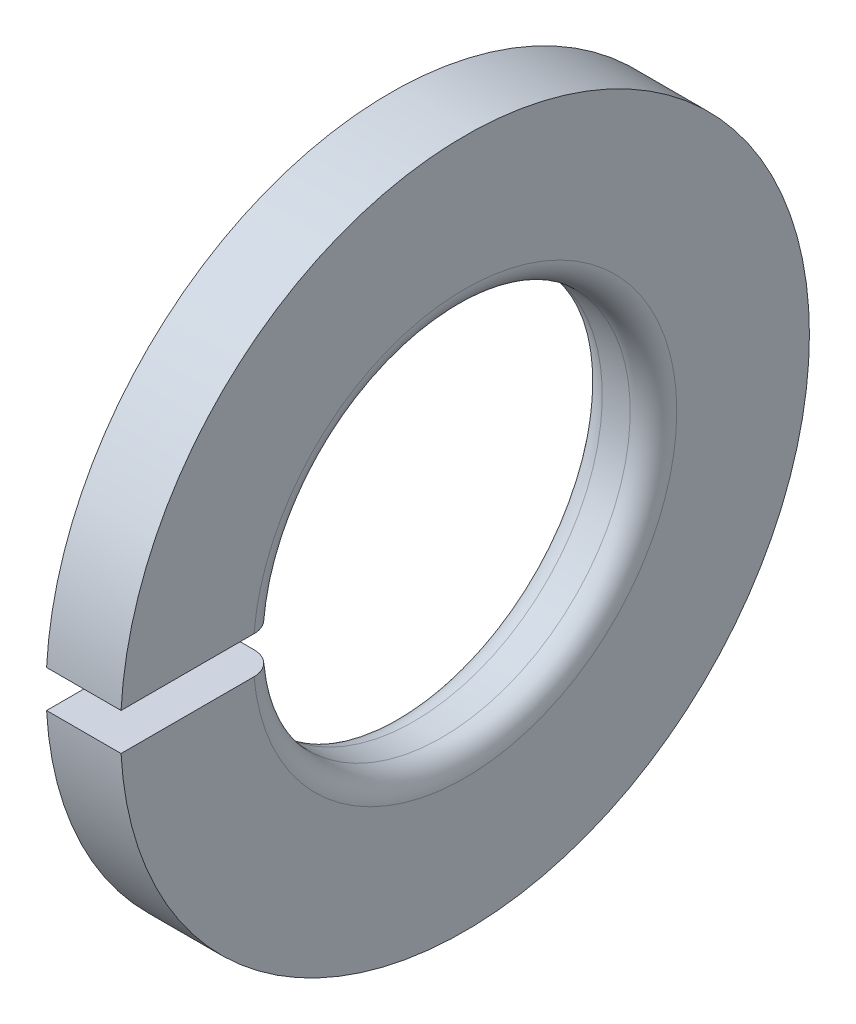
SolidWorks part; units mm, degrees
ref_plane "Plane1" through (0, 0, 0) normal (0, 0, 1) x (1, 0, 0)
ref_plane "Plane2" through (0, 0, 0) normal (0, 1, 0) x (1, 0, 0)
ref_plane "Plane3" through (0, 0, 0) normal (1, 0, 0) x (0, 0, -1)
sketch "Sketch1" plane through (0, 0, 0) normal (0, 0, 1) x (1, 0, 0)
  line L0 (-34.925, 0) -> (9.525, 0) construction
  line L1 (0, 4.55) -> (0, 7.4)
  line L2 (0, 7.4) -> (-1.6, 7.4)
  line L3 (-1.6, 7.4) -> (-1.6, 4.55)
  line L4 (-1.1, 4.05) -> (-0.5, 4.05)
  arc A0 (-1.1, 4.05) -> (-1.6, 4.55) centre (-1.1, 4.55) cw
  arc A1 (0, 4.55) -> (-0.5, 4.05) centre (-0.5, 4.55) cw
  point P8 (-1.6, 4.05)
revolve "Base-Revolve" add sketch "Sketch1" angle 360 about L0
sketch "Sketch2" plane through (0, 0, 0) normal (-1, 0, 0) x (0, -1, 0)
  line L0 (-0.4, 0) -> (0.4, 0)
  line L1 (0, 0) -> (0, 12.7) construction
  line L2 (0.4, 0) -> (0.4, 7.548)
  line L3 (0.4, 7.548) -> (-0.4, 7.548)
  line L4 (-0.4, 7.548) -> (-0.4, 0)
extrude "Gap" cut sketch "Sketch2" along normal through all
equation "\"D1@Sketch1\" = \"Fillet_rad@Sketch1\""
equation "\"D1@Sketch2\" = \"Thickness@Sketch1\" * 0.5"
equation "\"D2@Sketch2\" = \"Outside_dia@Sketch1\" * 0.51"
